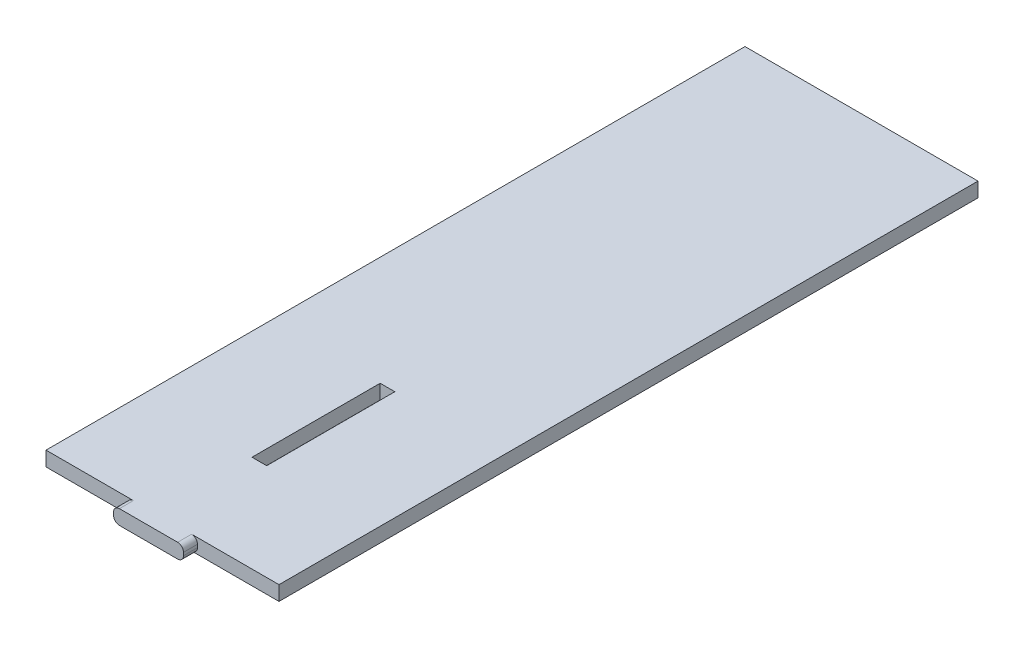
SolidWorks part; units mm, degrees
ref_plane "Front" through (0, 0, 0) normal (0, 0, 1) x (1, 0, 0)
ref_plane "Top" through (0, 0, 0) normal (0, 1, 0) x (1, 0, 0)
ref_plane "Right" through (0, 0, 0) normal (1, 0, 0) x (0, 0, -1)
sketch "Sketch1" plane through (0, 0, 0) normal (0, 1, 0) x (1, 0, 0)
  line L0 (-18.5578, -350) -> (-18.5578, 366.6328) construction
  line L1 (-118.5578, 250) -> (81.4422, 250)
  line L2 (-118.5578, -350) -> (81.4422, -350)
  line L15 (-118.5578, -350) -> (-118.5578, 250)
  line L16 (81.4422, -350) -> (81.4422, 250)
  point P7 (-18.5578, -350)
  point P13 (11.4422, 362.5)
  point P17 (-48.5578, 362.5)
  dimension "D2" = 600
  dimension "D3" = 60
  dimension "D1" = 200
extrude "Boss-Extrude1" add sketch "Sketch1" along normal blind 12.5
sketch "Sketch3" plane through (0, 0, 350) normal (0, 0, 1) x (1, 0, 0)
  line L0 (-118.5578, 12.5) -> (81.4422, 12.5) construction
  line L1 (-43.5578, 12.5) -> (6.4422, 12.5)
  line L2 (-48.5578, 7.5) -> (-48.5578, 5)
  line L3 (-43.5578, 0) -> (6.4422, 0)
  line L4 (11.4422, 7.5) -> (11.4422, 5)
  arc A0 (6.4422, 0) -> (11.4422, 5) centre (6.4422, 5) ccw
  arc A1 (-48.5578, 5) -> (-43.5578, 0) centre (-43.5578, 5) ccw
  arc A2 (-43.5578, 12.5) -> (-48.5578, 7.5) centre (-43.5578, 7.5) ccw
  arc A3 (6.4422, 12.5) -> (11.4422, 7.5) centre (6.4422, 7.5) cw
  point P4 (-18.5578, 12.5)
  point P7 (-18.5578, 12.5)
  point P12 (-48.5578, 0)
  point P15 (-48.5578, 12.5)
  point P18 (11.4422, 12.5)
  dimension "D3" = 5
  dimension "D1" = 12.5
  dimension "D2" = 60
extrude "Boss-Extrude2" add sketch "Sketch3" along normal blind 12
sketch "Sketch4" plane through (0, 0, 0) normal (0, -1, 0) x (1, 0, 0)
  line L0 (-18.5578, 362) -> (-18.5578, -250) construction
  line L1 (-43.5578, 362) -> (6.4422, 362) construction
  line L2 (81.4422, -250) -> (-118.5578, -250) construction
  line L3 (-18.5578, 234.28) -> (-18.5578, 156.88) construction
  line L4 (-12.2578, 266.88) -> (-12.2578, 156.88)
  line L5 (-24.8578, 266.88) -> (-24.8578, 156.88)
  line L6 (-12.2578, 266.88) -> (-24.8578, 266.88)
  line L7 (-12.2578, 156.88) -> (-24.8578, 156.88)
  point P8 (-18.5578, 195.58)
  dimension "D1" = 110
extrude "Cut-Extrude2" cut sketch "Sketch4" against normal blind 12.5
